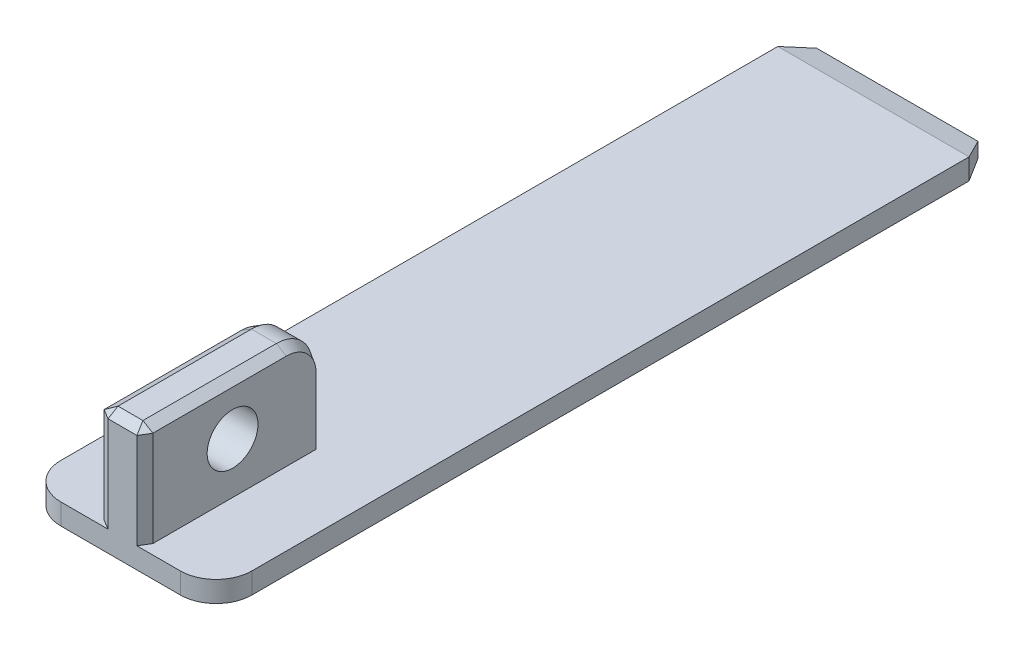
SolidWorks part; units mm, degrees
ref_plane "Ebene vorne" through (0, 0, 0) normal (0, 0, 1) x (1, 0, 0)
ref_plane "Ebene oben" through (0, 0, 0) normal (0, 1, 0) x (1, 0, 0)
ref_plane "Ebene rechts" through (0, 0, 0) normal (1, 0, 0) x (0, 0, -1)
sketch "Skizze1" plane through (0, 0, 0) normal (0, 0, 1) x (1, 0, 0)
  line L1 (-16, 1.75) -> (16, 1.75)
  line L2 (-16, 1.75) -> (-16, -1.75)
  line L3 (-16, -1.75) -> (16, -1.75)
  line L4 (16, 1.75) -> (16, -1.75)
  line L5 (-16, 1.75) -> (16, -1.75) construction
  line L6 (-16, -1.75) -> (16, 1.75) construction
  point P0 (0, 0)
  dimension "D1" = 32
  dimension "D2" = 3.5
extrude "Aufsatz-Linear austragen1" add sketch "Skizze1" along normal blind 130
chamfer "Fase1" distance 2.5 distance2 4 2 edges at (-16, 0, 0) (16, 0, 0)
chamfer "Fase2" distance 1 distance2 4 1 edges at (0, 1.75, 0)
sketch "Skizze2" plane through (0, 1.75, 0) normal (0, 1, 0) x (1, 0, 0)
  line L0 (0, -130) -> (0, -85.1947) construction
  line L1 (16, -130) -> (-16, -130) construction
  line L2 (-3.75, -130) -> (-3.75, -100)
  line L3 (-3.75, -100) -> (3.75, -100)
  line L4 (3.75, -130) -> (3.75, -100)
  line L5 (3.75, -130) -> (-3.75, -130)
  point P9 (0, -100)
  dimension "D1" = 7.5
  dimension "D2" = 30
extrude "Aufsatz-Linear austragen2" add sketch "Skizze2" along normal blind 17
sketch "Skizze3" plane through (3.75, 0, 0) normal (1, 0, 0) x (0, 0, -1)
  line L0 (-130, 10.25) -> (-100, 10.25) construction
  line L1 (-130, 18.75) -> (-130, 1.75) construction
  line L2 (-100, 18.75) -> (-100, 1.75) construction
  circle A0 centre (-115, 10.25) radius 4.25
  dimension "D1" = 8.5
  dimension "D2" = 15
extrude "Schnitt-Linear austragen1" cut sketch "Skizze3" against normal through all
fillet "Verrundung1" radius 6 1 edges at (0, 18.75, 100)
fillet "Verrundung2" radius 6 2 edges at (-16, 0, 130) (16, 0, 130)
chamfer "Fase3" distance 1 angle 59 9 edges at (3.75, 7.25, 100) (3.75, 16.9926, 101.7574) (3.75, 18.75, 118) (-3.75, 7.25, 100) (-3.75, 16.9926, 101.7574) (-3.75, 18.75, 118) (0, 18.75, 130) (3.75, 10.25, 130) (-3.75, 10.25, 130)
